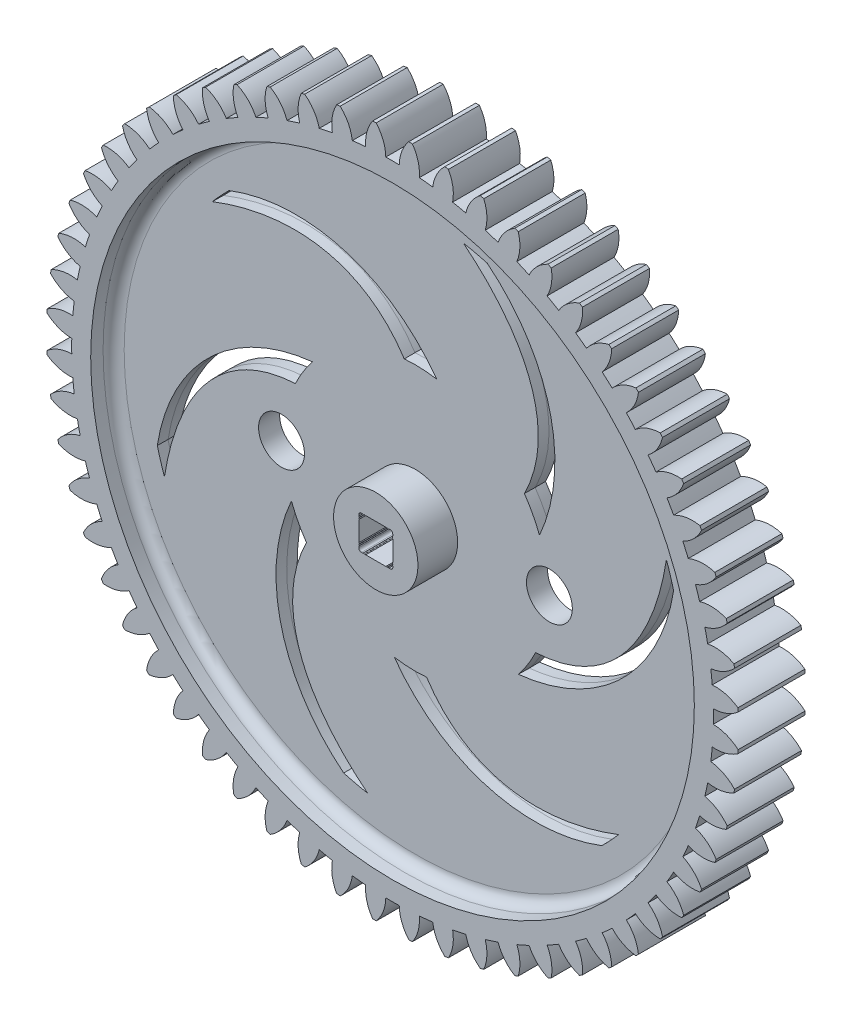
SolidWorks part; units mm, degrees
ref_plane "Front Plane" through (0, 0, 0) normal (0, 0, 1) x (1, 0, 0)
ref_plane "Top Plane" through (0, 0, 0) normal (0, 1, 0) x (1, 0, 0)
ref_plane "Right Plane" through (0, 0, 0) normal (1, 0, 0) x (0, 0, -1)
imported_body "Imported2"
imported_body "Imported3"
sketch "Sketch1" plane through (0, 0, -3.175) normal (0, 0, -1) x (-1, 0, 0)
  arc A0 (32.7497, 1.8883) -> (32.4267, 4.962) centre (0, 0) ccw
  arc A1 (32.4267, 4.962) -> (30.1776, 3.8123) centre (29.7121, 7.4977) cw
  arc A2 (30.1776, 3.8123) -> (30.3108, 2.5453) centre (0, 0) cw
  arc A3 (30.3108, 2.5453) -> (32.7497, 1.8883) centre (30.6217, -1.1564) cw
extrude "Cut-Extrude1" cut sketch "Sketch1" against normal up to next
sketch "Sketch2" plane through (0, 0, -3.175) normal (0, 0, -1) x (-1, 0, 0)
  arc A0 (32.7677, -1.5453) -> (32.7677, 1.5453) centre (0, 0) ccw
  arc A1 (32.7677, 1.5453) -> (30.4108, 0.637) centre (30.333, 4.3509) cw
  arc A2 (30.4108, 0.637) -> (30.4108, -0.637) centre (0, 0) cw
  arc A3 (30.4108, -0.637) -> (32.7677, -1.5453) centre (30.333, -4.3509) cw
extrude "Cut-Extrude2" cut sketch "Sketch2" against normal up to next
sketch "Sketch3" plane through (0, 0, -3.175) normal (0, 0, -1) x (-1, 0, 0)
  arc A0 (32.4267, -4.962) -> (32.7497, -1.8883) centre (0, 0) ccw
  arc A1 (32.7497, -1.8883) -> (30.3108, -2.5453) centre (30.6217, 1.1564) cw
  arc A2 (30.3108, -2.5453) -> (30.1776, -3.8123) centre (0, 0) cw
  arc A3 (30.1776, -3.8123) -> (32.4267, -4.962) centre (29.7121, -7.4977) cw
extrude "Cut-Extrude3" cut sketch "Sketch3" against normal up to next
sketch "Sketch4" plane through (0, 0, -3.175) normal (0, 0, -1) x (-1, 0, 0)
  arc A0 (31.7303, -8.3243) -> (32.3729, -5.3013) centre (0, 0) ccw
  arc A1 (32.3729, -5.3013) -> (29.8787, -5.6997) centre (30.5748, -2.0508) cw
  arc A2 (29.8787, -5.6997) -> (29.6138, -6.9459) centre (0, 0) cw
  arc A3 (29.6138, -6.9459) -> (31.7303, -8.3243) centre (28.7656, -10.5624) cw
extrude "Cut-Extrude4" cut sketch "Sketch4" against normal up to next
sketch "Sketch5" plane through (0, 0, -3.175) normal (0, 0, -1) x (-1, 0, 0)
  arc A0 (30.6864, -11.5954) -> (31.6414, -8.6561) centre (0, 0) ccw
  arc A1 (31.6414, -8.6561) -> (29.1193, -8.7916) centre (30.1929, -5.2355) cw
  arc A2 (29.1193, -8.7916) -> (28.7256, -10.0033) centre (0, 0) cw
  arc A3 (28.7256, -10.0033) -> (30.6864, -11.5954) centre (27.5039, -13.5114) cw
extrude "Cut-Extrude5" cut sketch "Sketch5" against normal up to next
sketch "Sketch6" plane through (0, 0, -3.175) normal (0, 0, -1) x (-1, 0, 0)
  arc A0 (29.3062, -14.7395) -> (30.5633, -11.9161) centre (0, 0) ccw
  arc A1 (30.5633, -11.9161) -> (28.0408, -11.7873) centre (29.4803, -8.3628) cw
  arc A2 (28.0408, -11.7873) -> (27.5226, -12.9511) centre (0, 0) cw
  arc A3 (27.5226, -12.9511) -> (29.3062, -14.7395) centre (25.9409, -16.3123) cw
extrude "Cut-Extrude6" cut sketch "Sketch6" against normal up to next
sketch "Sketch7" plane through (0, 0, -3.175) normal (0, 0, -1) x (-1, 0, 0)
  arc A0 (27.605, -17.7221) -> (29.1503, -15.0456) centre (0, 0) ccw
  arc A1 (29.1503, -15.0456) -> (26.6551, -14.6537) centre (28.4446, -11.3985) cw
  arc A2 (26.6551, -14.6537) -> (26.018, -15.7571) centre (0, 0) cw
  arc A3 (26.018, -15.7571) -> (27.605, -17.7221) centre (24.0937, -18.9345) cw
extrude "Cut-Extrude7" cut sketch "Sketch7" against normal up to next
sketch "Sketch8" plane through (0, 0, -3.175) normal (0, 0, -1) x (-1, 0, 0)
  arc A0 (25.6013, -20.5105) -> (27.4179, -18.0102) centre (0, 0) ccw
  arc A1 (27.4179, -18.0102) -> (24.9773, -17.3597) centre (27.0973, -14.3094) cw
  arc A2 (24.9773, -17.3597) -> (24.2284, -18.3904) centre (0, 0) cw
  arc A3 (24.2284, -18.3904) -> (25.6013, -20.5105) centre (21.9825, -21.3493) cw
extrude "Cut-Extrude8" cut sketch "Sketch8" against normal up to next
sketch "Sketch9" plane through (0, 0, -3.175) normal (0, 0, -1) x (-1, 0, 0)
  arc A0 (23.3171, -23.0742) -> (25.3851, -20.7775) centre (0, 0) ccw
  arc A1 (25.3851, -20.7775) -> (23.0259, -19.8754) centre (25.4532, -17.0634) cw
  arc A2 (23.0259, -19.8754) -> (22.1734, -20.8222) centre (0, 0) cw
  arc A3 (22.1734, -20.8222) -> (23.3171, -23.0742) centre (19.6305, -23.5301) cw
extrude "Cut-Extrude9" cut sketch "Sketch9" against normal up to next
sketch "Sketch10" plane through (0, 0, -3.175) normal (0, 0, -1) x (-1, 0, 0)
  arc A0 (20.7775, -25.3851) -> (23.0742, -23.3171) centre (0, 0) ccw
  arc A1 (23.0742, -23.3171) -> (20.8222, -22.1734) centre (23.5301, -19.6305) cw
  arc A2 (20.8222, -22.1734) -> (19.8754, -23.0259) centre (0, 0) cw
  arc A3 (19.8754, -23.0259) -> (20.7775, -25.3851) centre (17.0634, -25.4532) cw
extrude "Cut-Extrude10" cut sketch "Sketch10" against normal up to next
sketch "Sketch11" plane through (0, 0, -3.175) normal (0, 0, -1) x (-1, 0, 0)
  arc A0 (18.0102, -27.4179) -> (20.5105, -25.6013) centre (0, 0) ccw
  arc A1 (20.5105, -25.6013) -> (18.3904, -24.2284) centre (21.3493, -21.9825) cw
  arc A2 (18.3904, -24.2284) -> (17.3597, -24.9773) centre (0, 0) cw
  arc A3 (17.3597, -24.9773) -> (18.0102, -27.4179) centre (14.3094, -27.0973) cw
extrude "Cut-Extrude11" cut sketch "Sketch11" against normal up to next
sketch "Sketch12" plane through (0, 0, -3.175) normal (0, 0, -1) x (-1, 0, 0)
  arc A0 (15.0456, -29.1503) -> (17.7221, -27.605) centre (0, 0) ccw
  arc A1 (17.7221, -27.605) -> (15.7571, -26.018) centre (18.9345, -24.0937) cw
  arc A2 (15.7571, -26.018) -> (14.6537, -26.6551) centre (0, 0) cw
  arc A3 (14.6537, -26.6551) -> (15.0456, -29.1503) centre (11.3985, -28.4446) cw
extrude "Cut-Extrude12" cut sketch "Sketch12" against normal up to next
sketch "Sketch13" plane through (0, 0, -3.175) normal (0, 0, -1) x (-1, 0, 0)
  arc A0 (11.9161, -30.5633) -> (14.7395, -29.3062) centre (0, 0) ccw
  arc A1 (14.7395, -29.3062) -> (12.9511, -27.5226) centre (16.3123, -25.9409) cw
  arc A2 (12.9511, -27.5226) -> (11.7873, -28.0408) centre (0, 0) cw
  arc A3 (11.7873, -28.0408) -> (11.9161, -30.5633) centre (8.3628, -29.4803) cw
extrude "Cut-Extrude13" cut sketch "Sketch13" against normal up to next
sketch "Sketch14" plane through (0, 0, -3.175) normal (0, 0, -1) x (-1, 0, 0)
  arc A0 (8.6561, -31.6414) -> (11.5954, -30.6864) centre (0, 0) ccw
  arc A1 (11.5954, -30.6864) -> (10.0033, -28.7256) centre (13.5114, -27.5039) cw
  arc A2 (10.0033, -28.7256) -> (8.7916, -29.1193) centre (0, 0) cw
  arc A3 (8.7916, -29.1193) -> (8.6561, -31.6414) centre (5.2355, -30.1929) cw
extrude "Cut-Extrude14" cut sketch "Sketch14" against normal up to next
sketch "Sketch15" plane through (0, 0, -3.175) normal (0, 0, -1) x (-1, 0, 0)
  arc A0 (5.3013, -32.3729) -> (8.3243, -31.7303) centre (0, 0) ccw
  arc A1 (8.3243, -31.7303) -> (6.9459, -29.6138) centre (10.5624, -28.7656) cw
  arc A2 (6.9459, -29.6138) -> (5.6997, -29.8787) centre (0, 0) cw
  arc A3 (5.6997, -29.8787) -> (5.3013, -32.3729) centre (2.0508, -30.5748) cw
extrude "Cut-Extrude15" cut sketch "Sketch15" against normal up to next
sketch "Sketch16" plane through (0, 0, -3.175) normal (0, 0, -1) x (-1, 0, 0)
  arc A0 (1.8883, -32.7497) -> (4.962, -32.4267) centre (0, 0) ccw
  arc A1 (4.962, -32.4267) -> (3.8123, -30.1776) centre (7.4977, -29.7121) cw
  arc A2 (3.8123, -30.1776) -> (2.5453, -30.3108) centre (0, 0) cw
  arc A3 (2.5453, -30.3108) -> (1.8883, -32.7497) centre (-1.1564, -30.6217) cw
extrude "Cut-Extrude16" cut sketch "Sketch16" against normal up to next
sketch "Sketch17" plane through (0, 0, -3.175) normal (0, 0, -1) x (-1, 0, 0)
  arc A0 (-1.5453, -32.7677) -> (1.5453, -32.7677) centre (0, 0) ccw
  arc A1 (1.5453, -32.7677) -> (0.637, -30.4108) centre (4.3509, -30.333) cw
  arc A2 (0.637, -30.4108) -> (-0.637, -30.4108) centre (0, 0) cw
  arc A3 (-0.637, -30.4108) -> (-1.5453, -32.7677) centre (-4.3509, -30.333) cw
extrude "Cut-Extrude17" cut sketch "Sketch17" against normal up to next
sketch "Sketch18" plane through (0, 0, -3.175) normal (0, 0, -1) x (-1, 0, 0)
  arc A0 (-4.962, -32.4267) -> (-1.8883, -32.7497) centre (0, 0) ccw
  arc A1 (-1.8883, -32.7497) -> (-2.5453, -30.3108) centre (1.1564, -30.6217) cw
  arc A2 (-2.5453, -30.3108) -> (-3.8123, -30.1776) centre (0, 0) cw
  arc A3 (-3.8123, -30.1776) -> (-4.962, -32.4267) centre (-7.4977, -29.7121) cw
extrude "Cut-Extrude18" cut sketch "Sketch18" against normal up to next
sketch "Sketch19" plane through (0, 0, -3.175) normal (0, 0, -1) x (-1, 0, 0)
  arc A0 (-8.3243, -31.7303) -> (-5.3013, -32.3729) centre (0, 0) ccw
  arc A1 (-5.3013, -32.3729) -> (-5.6997, -29.8787) centre (-2.0508, -30.5748) cw
  arc A2 (-5.6997, -29.8787) -> (-6.9459, -29.6138) centre (0, 0) cw
  arc A3 (-6.9459, -29.6138) -> (-8.3243, -31.7303) centre (-10.5624, -28.7656) cw
extrude "Cut-Extrude19" cut sketch "Sketch19" against normal up to next
sketch "Sketch20" plane through (0, 0, -3.175) normal (0, 0, -1) x (-1, 0, 0)
  arc A0 (-11.5954, -30.6864) -> (-8.6561, -31.6414) centre (0, 0) ccw
  arc A1 (-8.6561, -31.6414) -> (-8.7916, -29.1193) centre (-5.2355, -30.1929) cw
  arc A2 (-8.7916, -29.1193) -> (-10.0033, -28.7256) centre (0, 0) cw
  arc A3 (-10.0033, -28.7256) -> (-11.5954, -30.6864) centre (-13.5114, -27.5039) cw
extrude "Cut-Extrude20" cut sketch "Sketch20" against normal up to next
sketch "Sketch21" plane through (0, 0, -3.175) normal (0, 0, -1) x (-1, 0, 0)
  arc A0 (-14.7395, -29.3062) -> (-11.9161, -30.5633) centre (0, 0) ccw
  arc A1 (-11.9161, -30.5633) -> (-11.7873, -28.0408) centre (-8.3628, -29.4803) cw
  arc A2 (-11.7873, -28.0408) -> (-12.9511, -27.5226) centre (0, 0) cw
  arc A3 (-12.9511, -27.5226) -> (-14.7395, -29.3062) centre (-16.3123, -25.9409) cw
extrude "Cut-Extrude21" cut sketch "Sketch21" against normal up to next
sketch "Sketch22" plane through (0, 0, -3.175) normal (0, 0, -1) x (-1, 0, 0)
  arc A0 (-17.7221, -27.605) -> (-15.0456, -29.1503) centre (0, 0) ccw
  arc A1 (-15.0456, -29.1503) -> (-14.6537, -26.6551) centre (-11.3985, -28.4446) cw
  arc A2 (-14.6537, -26.6551) -> (-15.7571, -26.018) centre (0, 0) cw
  arc A3 (-15.7571, -26.018) -> (-17.7221, -27.605) centre (-18.9345, -24.0937) cw
extrude "Cut-Extrude22" cut sketch "Sketch22" against normal up to next
sketch "Sketch23" plane through (0, 0, -3.175) normal (0, 0, -1) x (-1, 0, 0)
  arc A0 (-20.5105, -25.6013) -> (-18.0102, -27.4179) centre (0, 0) ccw
  arc A1 (-18.0102, -27.4179) -> (-17.3597, -24.9773) centre (-14.3094, -27.0973) cw
  arc A2 (-17.3597, -24.9773) -> (-18.3904, -24.2284) centre (0, 0) cw
  arc A3 (-18.3904, -24.2284) -> (-20.5105, -25.6013) centre (-21.3493, -21.9825) cw
extrude "Cut-Extrude23" cut sketch "Sketch23" against normal up to next
sketch "Sketch24" plane through (0, 0, -3.175) normal (0, 0, -1) x (-1, 0, 0)
  arc A0 (-23.0742, -23.3171) -> (-20.7775, -25.3851) centre (0, 0) ccw
  arc A1 (-20.7775, -25.3851) -> (-19.8754, -23.0259) centre (-17.0634, -25.4532) cw
  arc A2 (-19.8754, -23.0259) -> (-20.8222, -22.1734) centre (0, 0) cw
  arc A3 (-20.8222, -22.1734) -> (-23.0742, -23.3171) centre (-23.5301, -19.6305) cw
extrude "Cut-Extrude24" cut sketch "Sketch24" against normal up to next
sketch "Sketch25" plane through (0, 0, -3.175) normal (0, 0, -1) x (-1, 0, 0)
  arc A0 (-25.3851, -20.7775) -> (-23.3171, -23.0742) centre (0, 0) ccw
  arc A1 (-23.3171, -23.0742) -> (-22.1734, -20.8222) centre (-19.6305, -23.5301) cw
  arc A2 (-22.1734, -20.8222) -> (-23.0259, -19.8754) centre (0, 0) cw
  arc A3 (-23.0259, -19.8754) -> (-25.3851, -20.7775) centre (-25.4532, -17.0634) cw
extrude "Cut-Extrude25" cut sketch "Sketch25" against normal up to next
sketch "Sketch26" plane through (0, 0, -3.175) normal (0, 0, -1) x (-1, 0, 0)
  arc A0 (-27.4179, -18.0102) -> (-25.6013, -20.5105) centre (0, 0) ccw
  arc A1 (-25.6013, -20.5105) -> (-24.2284, -18.3904) centre (-21.9825, -21.3493) cw
  arc A2 (-24.2284, -18.3904) -> (-24.9773, -17.3597) centre (0, 0) cw
  arc A3 (-24.9773, -17.3597) -> (-27.4179, -18.0102) centre (-27.0973, -14.3094) cw
extrude "Cut-Extrude26" cut sketch "Sketch26" against normal up to next
sketch "Sketch27" plane through (0, 0, -3.175) normal (0, 0, -1) x (-1, 0, 0)
  arc A0 (-29.1503, -15.0456) -> (-27.605, -17.7221) centre (0, 0) ccw
  arc A1 (-27.605, -17.7221) -> (-26.018, -15.7571) centre (-24.0937, -18.9345) cw
  arc A2 (-26.018, -15.7571) -> (-26.6551, -14.6537) centre (0, 0) cw
  arc A3 (-26.6551, -14.6537) -> (-29.1503, -15.0456) centre (-28.4446, -11.3985) cw
extrude "Cut-Extrude27" cut sketch "Sketch27" against normal up to next
sketch "Sketch28" plane through (0, 0, -3.175) normal (0, 0, -1) x (-1, 0, 0)
  arc A0 (-30.5633, -11.9161) -> (-29.3062, -14.7395) centre (0, 0) ccw
  arc A1 (-29.3062, -14.7395) -> (-27.5226, -12.9511) centre (-25.9409, -16.3123) cw
  arc A2 (-27.5226, -12.9511) -> (-28.0408, -11.7873) centre (0, 0) cw
  arc A3 (-28.0408, -11.7873) -> (-30.5633, -11.9161) centre (-29.4803, -8.3628) cw
extrude "Cut-Extrude28" cut sketch "Sketch28" against normal up to next
sketch "Sketch29" plane through (0, 0, -3.175) normal (0, 0, -1) x (-1, 0, 0)
  arc A0 (-31.6414, -8.6561) -> (-30.6864, -11.5954) centre (0, 0) ccw
  arc A1 (-30.6864, -11.5954) -> (-28.7256, -10.0033) centre (-27.5039, -13.5114) cw
  arc A2 (-28.7256, -10.0033) -> (-29.1193, -8.7916) centre (0, 0) cw
  arc A3 (-29.1193, -8.7916) -> (-31.6414, -8.6561) centre (-30.1929, -5.2355) cw
extrude "Cut-Extrude29" cut sketch "Sketch29" against normal up to next
sketch "Sketch30" plane through (0, 0, -3.175) normal (0, 0, -1) x (-1, 0, 0)
  arc A0 (-32.3729, -5.3013) -> (-31.7303, -8.3243) centre (0, 0) ccw
  arc A1 (-31.7303, -8.3243) -> (-29.6138, -6.9459) centre (-28.7656, -10.5624) cw
  arc A2 (-29.6138, -6.9459) -> (-29.8787, -5.6997) centre (0, 0) cw
  arc A3 (-29.8787, -5.6997) -> (-32.3729, -5.3013) centre (-30.5748, -2.0508) cw
extrude "Cut-Extrude30" cut sketch "Sketch30" against normal up to next
sketch "Sketch31" plane through (0, 0, -3.175) normal (0, 0, -1) x (-1, 0, 0)
  arc A0 (-32.7497, -1.8883) -> (-32.4267, -4.962) centre (0, 0) ccw
  arc A1 (-32.4267, -4.962) -> (-30.1776, -3.8123) centre (-29.7121, -7.4977) cw
  arc A2 (-30.1776, -3.8123) -> (-30.3108, -2.5453) centre (0, 0) cw
  arc A3 (-30.3108, -2.5453) -> (-32.7497, -1.8883) centre (-30.6217, 1.1564) cw
extrude "Cut-Extrude31" cut sketch "Sketch31" against normal up to next
sketch "Sketch32" plane through (0, 0, -3.175) normal (0, 0, -1) x (-1, 0, 0)
  arc A0 (-32.7677, 1.5453) -> (-32.7677, -1.5453) centre (0, 0) ccw
  arc A1 (-32.7677, -1.5453) -> (-30.4108, -0.637) centre (-30.333, -4.3509) cw
  arc A2 (-30.4108, -0.637) -> (-30.4108, 0.637) centre (0, 0) cw
  arc A3 (-30.4108, 0.637) -> (-32.7677, 1.5453) centre (-30.333, 4.3509) cw
extrude "Cut-Extrude32" cut sketch "Sketch32" against normal up to next
sketch "Sketch33" plane through (0, 0, -3.175) normal (0, 0, -1) x (-1, 0, 0)
  arc A0 (-32.4267, 4.962) -> (-32.7497, 1.8883) centre (0, 0) ccw
  arc A1 (-32.7497, 1.8883) -> (-30.3108, 2.5453) centre (-30.6217, -1.1564) cw
  arc A2 (-30.3108, 2.5453) -> (-30.1776, 3.8123) centre (0, 0) cw
  arc A3 (-30.1776, 3.8123) -> (-32.4267, 4.962) centre (-29.7121, 7.4977) cw
extrude "Cut-Extrude33" cut sketch "Sketch33" against normal up to next
sketch "Sketch34" plane through (0, 0, -3.175) normal (0, 0, -1) x (-1, 0, 0)
  arc A0 (-31.7303, 8.3243) -> (-32.3729, 5.3013) centre (0, 0) ccw
  arc A1 (-32.3729, 5.3013) -> (-29.8787, 5.6997) centre (-30.5748, 2.0508) cw
  arc A2 (-29.8787, 5.6997) -> (-29.6138, 6.9459) centre (0, 0) cw
  arc A3 (-29.6138, 6.9459) -> (-31.7303, 8.3243) centre (-28.7656, 10.5624) cw
extrude "Cut-Extrude34" cut sketch "Sketch34" against normal up to next
sketch "Sketch35" plane through (0, 0, -3.175) normal (0, 0, -1) x (-1, 0, 0)
  arc A0 (-30.6864, 11.5954) -> (-31.6414, 8.6561) centre (0, 0) ccw
  arc A1 (-31.6414, 8.6561) -> (-29.1193, 8.7916) centre (-30.1929, 5.2355) cw
  arc A2 (-29.1193, 8.7916) -> (-28.7256, 10.0033) centre (0, 0) cw
  arc A3 (-28.7256, 10.0033) -> (-30.6864, 11.5954) centre (-27.5039, 13.5114) cw
extrude "Cut-Extrude35" cut sketch "Sketch35" against normal up to next
sketch "Sketch36" plane through (0, 0, -3.175) normal (0, 0, -1) x (-1, 0, 0)
  arc A0 (-29.3062, 14.7395) -> (-30.5633, 11.9161) centre (0, 0) ccw
  arc A1 (-30.5633, 11.9161) -> (-28.0408, 11.7873) centre (-29.4803, 8.3628) cw
  arc A2 (-28.0408, 11.7873) -> (-27.5226, 12.9511) centre (0, 0) cw
  arc A3 (-27.5226, 12.9511) -> (-29.3062, 14.7395) centre (-25.9409, 16.3123) cw
extrude "Cut-Extrude36" cut sketch "Sketch36" against normal up to next
sketch "Sketch37" plane through (0, 0, -3.175) normal (0, 0, -1) x (-1, 0, 0)
  arc A0 (-27.605, 17.7221) -> (-29.1503, 15.0456) centre (0, 0) ccw
  arc A1 (-29.1503, 15.0456) -> (-26.6551, 14.6537) centre (-28.4446, 11.3985) cw
  arc A2 (-26.6551, 14.6537) -> (-26.018, 15.7571) centre (0, 0) cw
  arc A3 (-26.018, 15.7571) -> (-27.605, 17.7221) centre (-24.0937, 18.9345) cw
extrude "Cut-Extrude37" cut sketch "Sketch37" against normal up to next
sketch "Sketch38" plane through (0, 0, -3.175) normal (0, 0, -1) x (-1, 0, 0)
  arc A0 (-25.6013, 20.5105) -> (-27.4179, 18.0102) centre (0, 0) ccw
  arc A1 (-27.4179, 18.0102) -> (-24.9773, 17.3597) centre (-27.0973, 14.3094) cw
  arc A2 (-24.9773, 17.3597) -> (-24.2284, 18.3904) centre (0, 0) cw
  arc A3 (-24.2284, 18.3904) -> (-25.6013, 20.5105) centre (-21.9825, 21.3493) cw
extrude "Cut-Extrude38" cut sketch "Sketch38" against normal up to next
sketch "Sketch39" plane through (0, 0, -3.175) normal (0, 0, -1) x (-1, 0, 0)
  arc A0 (-23.3171, 23.0742) -> (-25.3851, 20.7775) centre (0, 0) ccw
  arc A1 (-25.3851, 20.7775) -> (-23.0259, 19.8754) centre (-25.4532, 17.0634) cw
  arc A2 (-23.0259, 19.8754) -> (-22.1734, 20.8222) centre (0, 0) cw
  arc A3 (-22.1734, 20.8222) -> (-23.3171, 23.0742) centre (-19.6305, 23.5301) cw
extrude "Cut-Extrude39" cut sketch "Sketch39" against normal up to next
sketch "Sketch40" plane through (0, 0, -3.175) normal (0, 0, -1) x (-1, 0, 0)
  arc A0 (-20.7775, 25.3851) -> (-23.0742, 23.3171) centre (0, 0) ccw
  arc A1 (-23.0742, 23.3171) -> (-20.8222, 22.1734) centre (-23.5301, 19.6305) cw
  arc A2 (-20.8222, 22.1734) -> (-19.8754, 23.0259) centre (0, 0) cw
  arc A3 (-19.8754, 23.0259) -> (-20.7775, 25.3851) centre (-17.0634, 25.4532) cw
extrude "Cut-Extrude40" cut sketch "Sketch40" against normal up to next
sketch "Sketch41" plane through (0, 0, -3.175) normal (0, 0, -1) x (-1, 0, 0)
  arc A0 (-20.5105, 25.6013) -> (-18.3904, 24.2284) centre (-21.3493, 21.9825) cw
  arc A1 (-18.3904, 24.2284) -> (-17.3597, 24.9773) centre (0, 0) cw
  arc A2 (-17.3597, 24.9773) -> (-18.0102, 27.4179) centre (-14.3094, 27.0973) cw
  arc A3 (-18.0102, 27.4179) -> (-20.5105, 25.6013) centre (0, 0) ccw
extrude "Cut-Extrude41" cut sketch "Sketch41" against normal up to next
sketch "Sketch42" plane through (0, 0, -3.175) normal (0, 0, -1) x (-1, 0, 0)
  arc A0 (-17.7221, 27.605) -> (-15.7571, 26.018) centre (-18.9345, 24.0937) cw
  arc A1 (-15.7571, 26.018) -> (-14.6537, 26.6551) centre (0, 0) cw
  arc A2 (-14.6537, 26.6551) -> (-15.0456, 29.1503) centre (-11.3985, 28.4446) cw
  arc A3 (-15.0456, 29.1503) -> (-17.7221, 27.605) centre (0, 0) ccw
extrude "Cut-Extrude42" cut sketch "Sketch42" against normal up to next
sketch "Sketch43" plane through (0, 0, -3.175) normal (0, 0, -1) x (-1, 0, 0)
  arc A0 (-11.9161, 30.5633) -> (-14.7395, 29.3062) centre (0, 0) ccw
  arc A1 (-14.7395, 29.3062) -> (-12.9511, 27.5226) centre (-16.3123, 25.9409) cw
  arc A2 (-12.9511, 27.5226) -> (-11.7873, 28.0408) centre (0, 0) cw
  arc A3 (-11.7873, 28.0408) -> (-11.9161, 30.5633) centre (-8.3628, 29.4803) cw
extrude "Cut-Extrude43" cut sketch "Sketch43" against normal up to next
sketch "Sketch44" plane through (0, 0, -3.175) normal (0, 0, -1) x (-1, 0, 0)
  arc A0 (-8.6561, 31.6414) -> (-11.5954, 30.6864) centre (0, 0) ccw
  arc A1 (-11.5954, 30.6864) -> (-10.0033, 28.7256) centre (-13.5114, 27.5039) cw
  arc A2 (-10.0033, 28.7256) -> (-8.7916, 29.1193) centre (0, 0) cw
  arc A3 (-8.7916, 29.1193) -> (-8.6561, 31.6414) centre (-5.2355, 30.1929) cw
extrude "Cut-Extrude44" cut sketch "Sketch44" against normal up to next
sketch "Sketch45" plane through (0, 0, -3.175) normal (0, 0, -1) x (-1, 0, 0)
  arc A0 (-5.3013, 32.3729) -> (-8.3243, 31.7303) centre (0, 0) ccw
  arc A1 (-8.3243, 31.7303) -> (-6.9459, 29.6138) centre (-10.5624, 28.7656) cw
  arc A2 (-6.9459, 29.6138) -> (-5.6997, 29.8787) centre (0, 0) cw
  arc A3 (-5.6997, 29.8787) -> (-5.3013, 32.3729) centre (-2.0508, 30.5748) cw
extrude "Cut-Extrude45" cut sketch "Sketch45" against normal up to next
sketch "Sketch46" plane through (0, 0, -3.175) normal (0, 0, -1) x (-1, 0, 0)
  arc A0 (-1.8883, 32.7497) -> (-4.962, 32.4267) centre (0, 0) ccw
  arc A1 (-4.962, 32.4267) -> (-3.8123, 30.1776) centre (-7.4977, 29.7121) cw
  arc A2 (-3.8123, 30.1776) -> (-2.5453, 30.3108) centre (0, 0) cw
  arc A3 (-2.5453, 30.3108) -> (-1.8883, 32.7497) centre (1.1564, 30.6217) cw
extrude "Cut-Extrude46" cut sketch "Sketch46" against normal up to next
sketch "Sketch47" plane through (0, 0, -3.175) normal (0, 0, -1) x (-1, 0, 0)
  arc A0 (1.5453, 32.7677) -> (-1.5453, 32.7677) centre (0, 0) ccw
  arc A1 (-1.5453, 32.7677) -> (-0.637, 30.4108) centre (-4.3509, 30.333) cw
  arc A2 (-0.637, 30.4108) -> (0.637, 30.4108) centre (0, 0) cw
  arc A3 (0.637, 30.4108) -> (1.5453, 32.7677) centre (4.3509, 30.333) cw
extrude "Cut-Extrude47" cut sketch "Sketch47" against normal up to next
sketch "Sketch48" plane through (0, 0, -3.175) normal (0, 0, -1) x (-1, 0, 0)
  arc A0 (4.962, 32.4267) -> (1.8883, 32.7497) centre (0, 0) ccw
  arc A1 (1.8883, 32.7497) -> (2.5453, 30.3108) centre (-1.1564, 30.6217) cw
  arc A2 (2.5453, 30.3108) -> (3.8123, 30.1776) centre (0, 0) cw
  arc A3 (3.8123, 30.1776) -> (4.962, 32.4267) centre (7.4977, 29.7121) cw
extrude "Cut-Extrude48" cut sketch "Sketch48" against normal up to next
sketch "Sketch49" plane through (0, 0, -3.175) normal (0, 0, -1) x (-1, 0, 0)
  arc A0 (8.3243, 31.7303) -> (5.3013, 32.3729) centre (0, 0) ccw
  arc A1 (5.3013, 32.3729) -> (5.6997, 29.8787) centre (2.0508, 30.5748) cw
  arc A2 (5.6997, 29.8787) -> (6.9459, 29.6138) centre (0, 0) cw
  arc A3 (6.9459, 29.6138) -> (8.3243, 31.7303) centre (10.5624, 28.7656) cw
extrude "Cut-Extrude49" cut sketch "Sketch49" against normal up to next
sketch "Sketch50" plane through (0, 0, -3.175) normal (0, 0, -1) x (-1, 0, 0)
  arc A0 (11.5954, 30.6864) -> (8.6561, 31.6414) centre (0, 0) ccw
  arc A1 (8.6561, 31.6414) -> (8.7916, 29.1193) centre (5.2355, 30.1929) cw
  arc A2 (8.7916, 29.1193) -> (10.0033, 28.7256) centre (0, 0) cw
  arc A3 (10.0033, 28.7256) -> (11.5954, 30.6864) centre (13.5114, 27.5039) cw
extrude "Cut-Extrude50" cut sketch "Sketch50" against normal up to next
sketch "Sketch51" plane through (0, 0, -3.175) normal (0, 0, -1) x (-1, 0, 0)
  arc A0 (14.7395, 29.3062) -> (11.9161, 30.5633) centre (0, 0) ccw
  arc A1 (11.9161, 30.5633) -> (11.7873, 28.0408) centre (8.3628, 29.4803) cw
  arc A2 (11.7873, 28.0408) -> (12.9511, 27.5226) centre (0, 0) cw
  arc A3 (12.9511, 27.5226) -> (14.7395, 29.3062) centre (16.3123, 25.9409) cw
extrude "Cut-Extrude51" cut sketch "Sketch51" against normal up to next
sketch "Sketch52" plane through (0, 0, -3.175) normal (0, 0, -1) x (-1, 0, 0)
  arc A0 (17.7221, 27.605) -> (15.0456, 29.1503) centre (0, 0) ccw
  arc A1 (15.0456, 29.1503) -> (14.6537, 26.6551) centre (11.3985, 28.4446) cw
  arc A2 (14.6537, 26.6551) -> (15.7571, 26.018) centre (0, 0) cw
  arc A3 (15.7571, 26.018) -> (17.7221, 27.605) centre (18.9345, 24.0937) cw
extrude "Cut-Extrude52" cut sketch "Sketch52" against normal up to next
sketch "Sketch53" plane through (0, 0, -3.175) normal (0, 0, -1) x (-1, 0, 0)
  arc A0 (20.5105, 25.6013) -> (18.0102, 27.4179) centre (0, 0) ccw
  arc A1 (18.0102, 27.4179) -> (17.3597, 24.9773) centre (14.3094, 27.0973) cw
  arc A2 (17.3597, 24.9773) -> (18.3904, 24.2284) centre (0, 0) cw
  arc A3 (18.3904, 24.2284) -> (20.5105, 25.6013) centre (21.3493, 21.9825) cw
extrude "Cut-Extrude53" cut sketch "Sketch53" against normal up to next
sketch "Sketch54" plane through (0, 0, -3.175) normal (0, 0, -1) x (-1, 0, 0)
  arc A0 (23.0742, 23.3171) -> (20.7775, 25.3851) centre (0, 0) ccw
  arc A1 (20.7775, 25.3851) -> (19.8754, 23.0259) centre (17.0634, 25.4532) cw
  arc A2 (19.8754, 23.0259) -> (20.8222, 22.1734) centre (0, 0) cw
  arc A3 (20.8222, 22.1734) -> (23.0742, 23.3171) centre (23.5301, 19.6305) cw
extrude "Cut-Extrude54" cut sketch "Sketch54" against normal up to next
sketch "Sketch55" plane through (0, 0, -3.175) normal (0, 0, -1) x (-1, 0, 0)
  arc A0 (25.3851, 20.7775) -> (23.3171, 23.0742) centre (0, 0) ccw
  arc A1 (23.3171, 23.0742) -> (22.1734, 20.8222) centre (19.6305, 23.5301) cw
  arc A2 (22.1734, 20.8222) -> (23.0259, 19.8754) centre (0, 0) cw
  arc A3 (23.0259, 19.8754) -> (25.3851, 20.7775) centre (25.4532, 17.0634) cw
extrude "Cut-Extrude55" cut sketch "Sketch55" against normal up to next
sketch "Sketch56" plane through (0, 0, -3.175) normal (0, 0, -1) x (-1, 0, 0)
  arc A0 (27.4179, 18.0102) -> (25.6013, 20.5105) centre (0, 0) ccw
  arc A1 (25.6013, 20.5105) -> (24.2284, 18.3904) centre (21.9825, 21.3493) cw
  arc A2 (24.2284, 18.3904) -> (24.9773, 17.3597) centre (0, 0) cw
  arc A3 (24.9773, 17.3597) -> (27.4179, 18.0102) centre (27.0973, 14.3094) cw
extrude "Cut-Extrude56" cut sketch "Sketch56" against normal up to next
sketch "Sketch57" plane through (0, 0, -3.175) normal (0, 0, -1) x (-1, 0, 0)
  arc A0 (29.1503, 15.0456) -> (27.605, 17.7221) centre (0, 0) ccw
  arc A1 (27.605, 17.7221) -> (26.018, 15.7571) centre (24.0937, 18.9345) cw
  arc A2 (26.018, 15.7571) -> (26.6551, 14.6537) centre (0, 0) cw
  arc A3 (26.6551, 14.6537) -> (29.1503, 15.0456) centre (28.4446, 11.3985) cw
extrude "Cut-Extrude57" cut sketch "Sketch57" against normal up to next
sketch "Sketch58" plane through (0, 0, -3.175) normal (0, 0, -1) x (-1, 0, 0)
  arc A0 (30.5633, 11.9161) -> (29.3062, 14.7395) centre (0, 0) ccw
  arc A1 (29.3062, 14.7395) -> (27.5226, 12.9511) centre (25.9409, 16.3123) cw
  arc A2 (27.5226, 12.9511) -> (28.0408, 11.7873) centre (0, 0) cw
  arc A3 (28.0408, 11.7873) -> (30.5633, 11.9161) centre (29.4803, 8.3628) cw
extrude "Cut-Extrude58" cut sketch "Sketch58" against normal up to next
sketch "Sketch59" plane through (0, 0, -3.175) normal (0, 0, -1) x (-1, 0, 0)
  arc A0 (31.6414, 8.6561) -> (30.6864, 11.5954) centre (0, 0) ccw
  arc A1 (30.6864, 11.5954) -> (28.7256, 10.0033) centre (27.5039, 13.5114) cw
  arc A2 (28.7256, 10.0033) -> (29.1193, 8.7916) centre (0, 0) cw
  arc A3 (29.1193, 8.7916) -> (31.6414, 8.6561) centre (30.1929, 5.2355) cw
extrude "Cut-Extrude59" cut sketch "Sketch59" against normal up to next
sketch "Sketch60" plane through (0, 0, -3.175) normal (0, 0, -1) x (-1, 0, 0)
  arc A0 (32.3729, 5.3013) -> (31.7303, 8.3243) centre (0, 0) ccw
  arc A1 (31.7303, 8.3243) -> (29.6138, 6.9459) centre (28.7656, 10.5624) cw
  arc A2 (29.6138, 6.9459) -> (29.8787, 5.6997) centre (0, 0) cw
  arc A3 (29.8787, 5.6997) -> (32.3729, 5.3013) centre (30.5748, 2.0508) cw
extrude "Cut-Extrude60" cut sketch "Sketch60" against normal up to next
sketch "Sketch61" plane through (0, 0, 1) normal (0, 0, 1) x (1, 0, 0)
  circle A0 centre (0, 0) radius 4
extrude "Boss-Extrude1" add sketch "Sketch61" along normal blind 3.7625
sketch "Sketch62" plane through (0, 0, -1) normal (0, 0, -1) x (-1, 0, 0)
  circle A0 centre (0, 0) radius 4
extrude "Boss-Extrude2" add sketch "Sketch62" along normal blind 3.7625
sketch "Sketch63" plane through (0, 0, -4.7625) normal (0, 0, -1) x (-1, 0, 0)
  line L0 (-1.168, 1.549) -> (-1.2315, 1.6125)
  line L1 (-1.2315, 1.6125) -> (-1.6125, 1.6125)
  line L2 (-1.6125, 1.6125) -> (-1.6125, 1.2315)
  line L3 (-1.6125, 1.2315) -> (-1.5488, 1.1682)
  line L4 (-1.5488, 1.1682) -> (-1.6252, 1.0918)
  line L5 (-1.6252, 1.0918) -> (-1.549, 1.0156)
  line L6 (-1.549, 1.0156) -> (-1.6125, 0.9521)
  line L7 (-1.6125, 0.9521) -> (-1.6125, -0.9521)
  line L8 (-1.6125, -0.9521) -> (-1.549, -1.0156)
  line L9 (-1.549, -1.0156) -> (-1.6252, -1.0918)
  line L10 (-1.6252, -1.0918) -> (-1.549, -1.168)
  line L11 (-1.549, -1.168) -> (-1.6125, -1.2315)
  line L12 (-1.6125, -1.2315) -> (-1.6125, -1.6125)
  line L13 (-1.6125, -1.6125) -> (-1.2315, -1.6125)
  line L14 (-1.2315, -1.6125) -> (-1.1682, -1.5488)
  line L15 (-1.1682, -1.5488) -> (-1.0918, -1.6252)
  line L16 (-1.0918, -1.6252) -> (-1.0156, -1.549)
  line L17 (-1.0156, -1.549) -> (-0.9521, -1.6125)
  line L18 (-0.9521, -1.6125) -> (0.9521, -1.6125)
  line L19 (0.9521, -1.6125) -> (1.0156, -1.549)
  line L20 (1.0156, -1.549) -> (1.0918, -1.6252)
  line L21 (1.0918, -1.6252) -> (1.168, -1.549)
  line L22 (1.168, -1.549) -> (1.2315, -1.6125)
  line L23 (1.2315, -1.6125) -> (1.6125, -1.6125)
  line L24 (1.6125, -1.6125) -> (1.6125, -1.2315)
  line L25 (1.6125, -1.2315) -> (1.5488, -1.1682)
  line L26 (1.5488, -1.1682) -> (1.6252, -1.0918)
  line L27 (1.6252, -1.0918) -> (1.549, -1.0156)
  line L28 (1.549, -1.0156) -> (1.6125, -0.9521)
  line L29 (1.6125, -0.9521) -> (1.6125, 0.9521)
  line L30 (1.6125, 0.9521) -> (1.549, 1.0156)
  line L31 (1.549, 1.0156) -> (1.6252, 1.0918)
  line L32 (1.6252, 1.0918) -> (1.549, 1.168)
  line L33 (1.549, 1.168) -> (1.6125, 1.2315)
  line L34 (1.6125, 1.2315) -> (1.6125, 1.6125)
  line L35 (1.6125, 1.6125) -> (1.2315, 1.6125)
  line L36 (1.2315, 1.6125) -> (1.1682, 1.5488)
  line L37 (1.1682, 1.5488) -> (1.0918, 1.6252)
  line L38 (1.0918, 1.6252) -> (1.0156, 1.549)
  line L39 (1.0156, 1.549) -> (0.9521, 1.6125)
  line L40 (0.9521, 1.6125) -> (-0.9521, 1.6125)
  line L41 (-0.9521, 1.6125) -> (-1.0156, 1.549)
  line L42 (-1.0156, 1.549) -> (-1.0918, 1.6252)
  line L43 (-1.0918, 1.6252) -> (-1.168, 1.549)
extrude "Cut-Extrude61" cut sketch "Sketch63" against normal through all
hole_wizard "#8 Clearance Hole1" positions "Sketch65" profile "Sketch64" hole size "#8" standard "ANSI Inch"
sketch "Sketch65" plane through (0, 0, 1) normal (0, 0, 1) x (1, 0, 0)
  point P0 (-12.7, 0)
  point P1 (12.7, 0)
sketch "Sketch64" plane through (-12.7, 0, 1) normal (1, 0, 0) x (0, -1, 0)
  line L0 (0, 0) -> (0, 5.7625)
  line L1 (0, 5.7625) -> (2.175, 5.7625)
  line L2 (2.175, 5.7625) -> (2.175, 0)
  line L5 (2.175, 0) -> (0, 0)
  line L11 (0, -6.35) -> (0, 107.95) construction
  dimension "Thru Hole Dia." = 4.35
  dimension "Thru Hole Depth" = 5.7625
fillet "Fillet1" radius 0.0127 16 edges at (1.549, -1.0156, 0) (-1.549, 1.168, 0) (-1.168, -1.549, 0) (1.168, 1.549, 0) (-1.5488, -1.1682, 0) (-1.1682, 1.5488, 0) (1.0156, -1.549, 0) (1.549, 1.0156, 0) (-1.0156, -1.549, 0) (-1.549, 1.0156, 0) (-1.549, -1.0156, 0) (1.5488, 1.1682, 0) (-1.0156, 1.549, 0) (1.0156, 1.549, 0) (1.549, -1.168, 0) (1.1682, -1.5488, 0)
chamfer "Chamfer1" distance 0.018 angle 45 6 edges at (1.0918, 1.6252, 0) (1.0918, -1.6252, 0) (-1.6252, -1.0918, 0) (-1.6252, 1.0918, 0) (1.6252, -1.0918, 0) (1.6252, 1.0918, 0)
fillet "Fillet2" radius 0.25 4 edges at (-1.6125, 1.6125, 0) (-1.6125, -1.6125, 0) (1.6125, -1.6125, 0) (1.6125, 1.6125, 0)
fillet "Fillet3" radius 1 2 edges at (28.6175, 0, -1) (28.6175, 0, 1)
